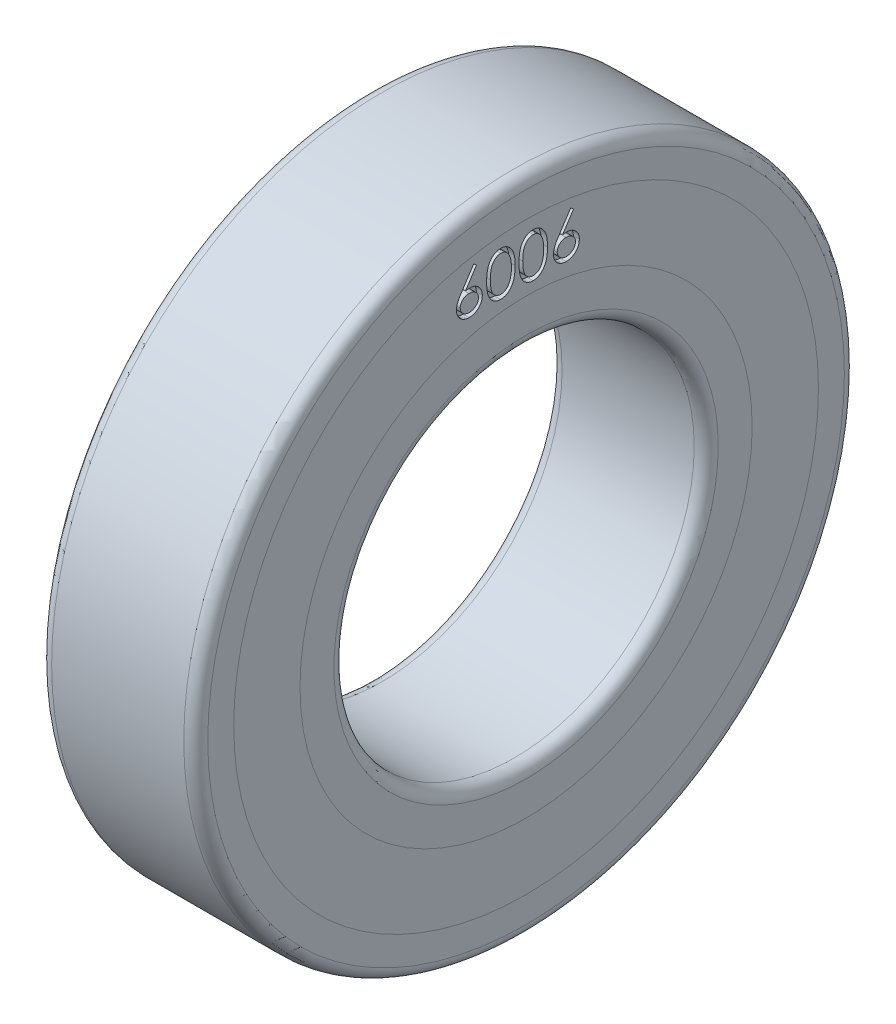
SolidWorks part; units mm, degrees
ref_plane "Front Plane" through (0, 0, 0) normal (0, 0, 1) x (1, 0, 0)
ref_plane "Top Plane" through (0, 0, 0) normal (0, 1, 0) x (1, 0, 0)
ref_plane "Right Plane" through (0, 0, 0) normal (1, 0, 0) x (0, 0, -1)
sketch "Sketch1" plane through (0, 0, 0) normal (1, 0, 0) x (0, 0, -1)
  circle A0 centre (0, 0) radius 15
  circle A1 centre (0, 0) radius 27.5
  dimension "D1" = 30
  dimension "D2" = 55
extrude "Boss-Extrude1" add sketch "Sketch1" along normal blind 13
fillet "Fillet1" radius 1 4 edges at (0, 0, -15) (13, 0, -15) (0, 0, -27.5) (13, 0, -27.5)
sketch "Sketch2" plane through (13, 0, 0) normal (1, 0, 0) x (0, 0, -1)
  circle A0 centre (0, 0) radius 18.8226
  circle A1 centre (0, 0) radius 24.3394
sketch "Sketch3" plane through (13, 0, 0) normal (1, 0, 0) x (0, 0, -1)
  text T0 "6006"
extrude "Cut-Extrude1" cut sketch "Sketch3" against normal blind 0.5
